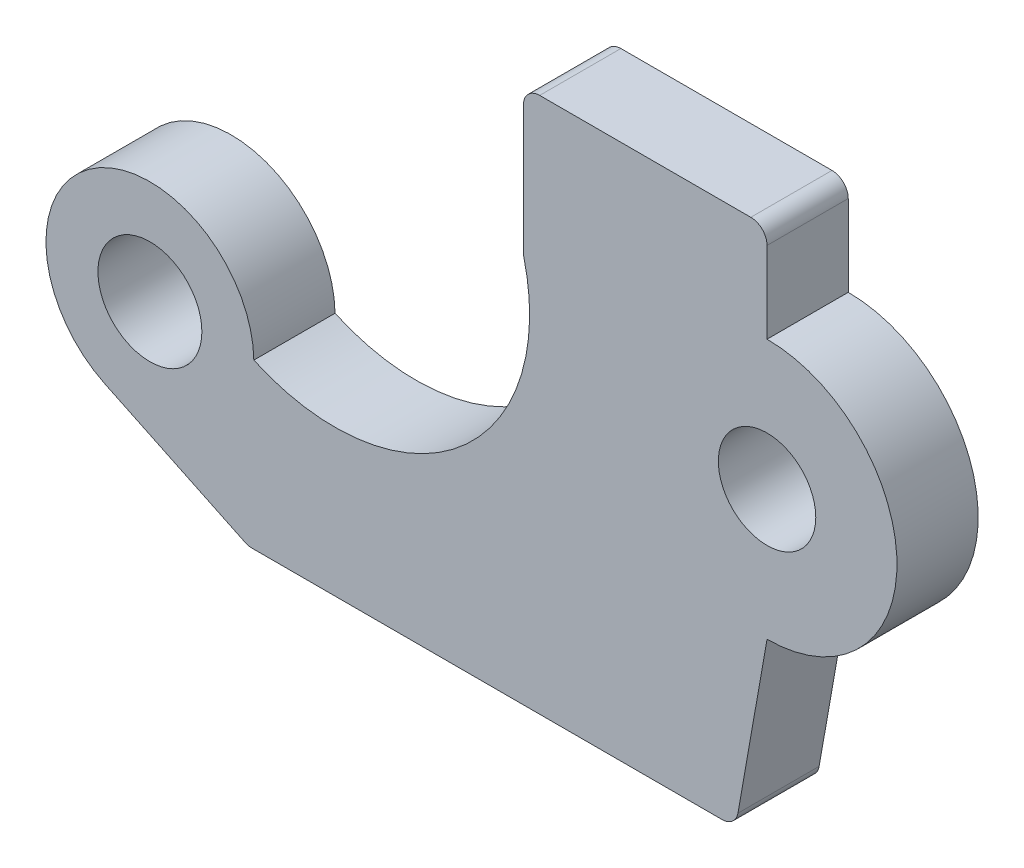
SolidWorks part; units mm, degrees
ref_plane "Front" through (0, 0, 0) normal (0, 0, 1) x (1, 0, 0)
ref_plane "Top" through (0, 0, 0) normal (0, 1, 0) x (1, 0, 0)
ref_plane "Right" through (0, 0, 0) normal (1, 0, 0) x (0, 0, -1)
sketch "Esquisse1" plane through (0, 0, 0) normal (0, 0, 1) x (1, 0, 0)
  line L0 (0, 4) -> (0, 7)
  line L1 (0, 7) -> (-7.5, 7)
  line L2 (-7.5, 7) -> (-7.5, 2.5)
  line L3 (0, -4) -> (-0.9698, -9.5)
  line L4 (-0.9698, -9.5) -> (-15.9698, -9.5)
  line L5 (-15.9698, -9.5) -> (-20.3826, -7.3859)
  circle A0 centre (0, 0) radius 1.5
  arc A1 (0, -4) -> (0, 4) centre (0, 0) ccw
  arc A2 (-15.8003, -4.4586) -> (-7.5, 2.5) centre (-13.3095, 1) ccw
  circle A3 centre (-19, -4.5) radius 1.6
  arc A4 (-15.8003, -4.4586) -> (-20.3826, -7.3859) centre (-19, -4.5) ccw
  dimension "D1" = 3
  dimension "D2" = 8
  dimension "D7" = 12
  dimension "D10" = 3.2
  dimension "D13" = 6.4
  dimension "D3" = 7.5
  dimension "D4" = 4.5
  dimension "D5" = 16.5
  dimension "D6" = 3
  dimension "D8" = 10.5
  dimension "D9" = 190
  dimension "D11" = 5
  dimension "D12" = 19
  dimension "D14" = 15
extrude "Boss.-Extru.1" add sketch "Esquisse1" along normal blind 2.5
fillet "Congé1" radius 0.5 4 edges at (-15.9698, -9.5, 1.25) (-0.9698, -9.5, 1.25) (0, 7, 1.25) (-7.5, 7, 1.25)
ref_plane "Plan1" through (0, 0, 1.25) normal (0, 0, 1) x (1, 0, 0)
